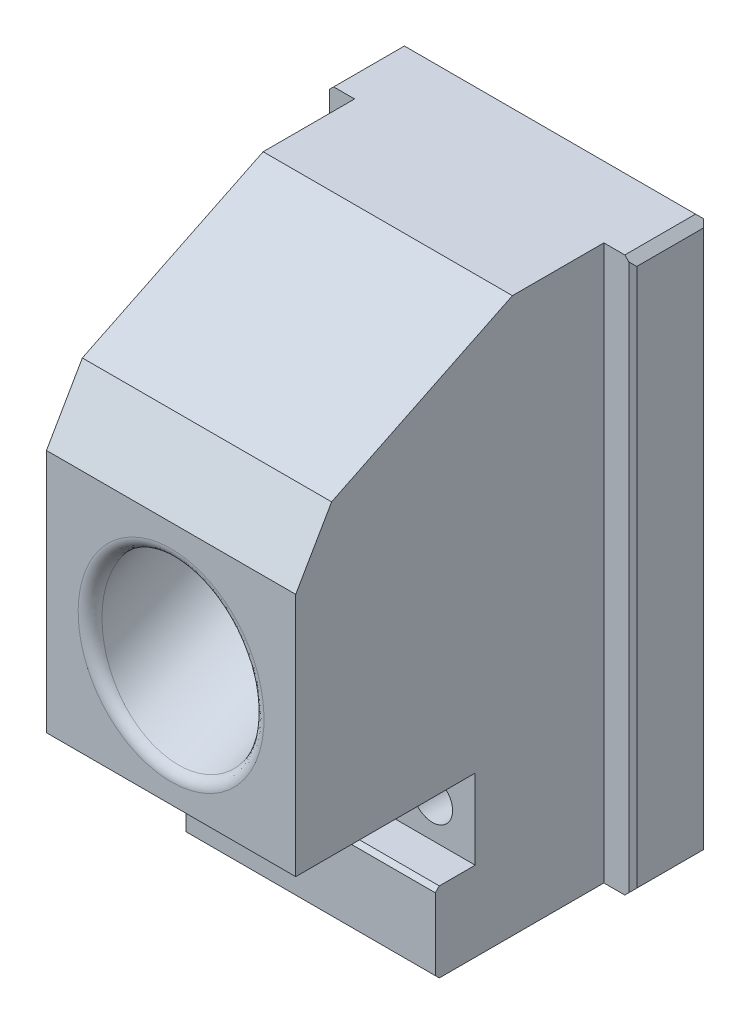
SolidWorks part; units mm, degrees
ref_plane "Front Plane" through (0, 0, 0) normal (0, 0, 1) x (1, 0, 0)
ref_plane "Top Plane" through (0, 0, 0) normal (0, 1, 0) x (1, 0, 0)
ref_plane "Right Plane" through (0, 0, 0) normal (1, 0, 0) x (0, 0, -1)
imported_body "Imported1"
sketch "Sketch1" plane through (0, 0, -24.384) normal (0, 0, -1) x (-1, 0, 0)
  line L0 (-9.779, 6.2865) -> (-9.779, 34.798) construction
  line L1 (-9.779, 6.5405) -> (9.779, 6.5405)
  line L2 (-9.779, 6.5405) -> (-9.779, 3.3655)
  line L3 (-9.779, 3.3655) -> (9.779, 3.3655)
  line L4 (9.779, 6.5405) -> (9.779, 3.3655)
  line L5 (9.779, 3.6195) -> (9.779, 0.508) construction
  line L6 (-9.525, 3.3655) -> (9.525, 3.3655) construction
  line L7 (-9.525, 6.5405) -> (9.525, 6.5405) construction
extrude "Boss-Extrude1" add sketch "Sketch1" against normal up to vertex
sketch "Sketch2" plane through (0, 3.3655, 0) normal (0, -1, 0) x (1, 0, 0)
  line L3 (9.779, -24.384) -> (9.779, -24.13)
  line L4 (9.779, -24.13) -> (9.525, -24.384)
  line L5 (9.525, -24.384) -> (9.779, -24.384)
  line L6 (9.779, -24.384) -> (9.779, -24.13)
  line L7 (9.779, -24.13) -> (9.525, -24.384)
  line L8 (9.525, -24.384) -> (9.779, -24.384)
  line L9 (-9.779, -24.384) -> (-9.525, -24.384)
  line L10 (-9.525, -24.384) -> (-9.779, -24.13)
  line L11 (-9.779, -24.13) -> (-9.779, -24.384)
  line L12 (-9.779, -24.384) -> (-9.525, -24.384)
  line L13 (-9.525, -24.384) -> (-9.779, -24.13)
  line L14 (-9.779, -24.13) -> (-9.779, -24.384)
  dimension "D1" = 0
  dimension "D2" = 0
extrude "Cut-Extrude1" cut sketch "Sketch2" against normal up to next
